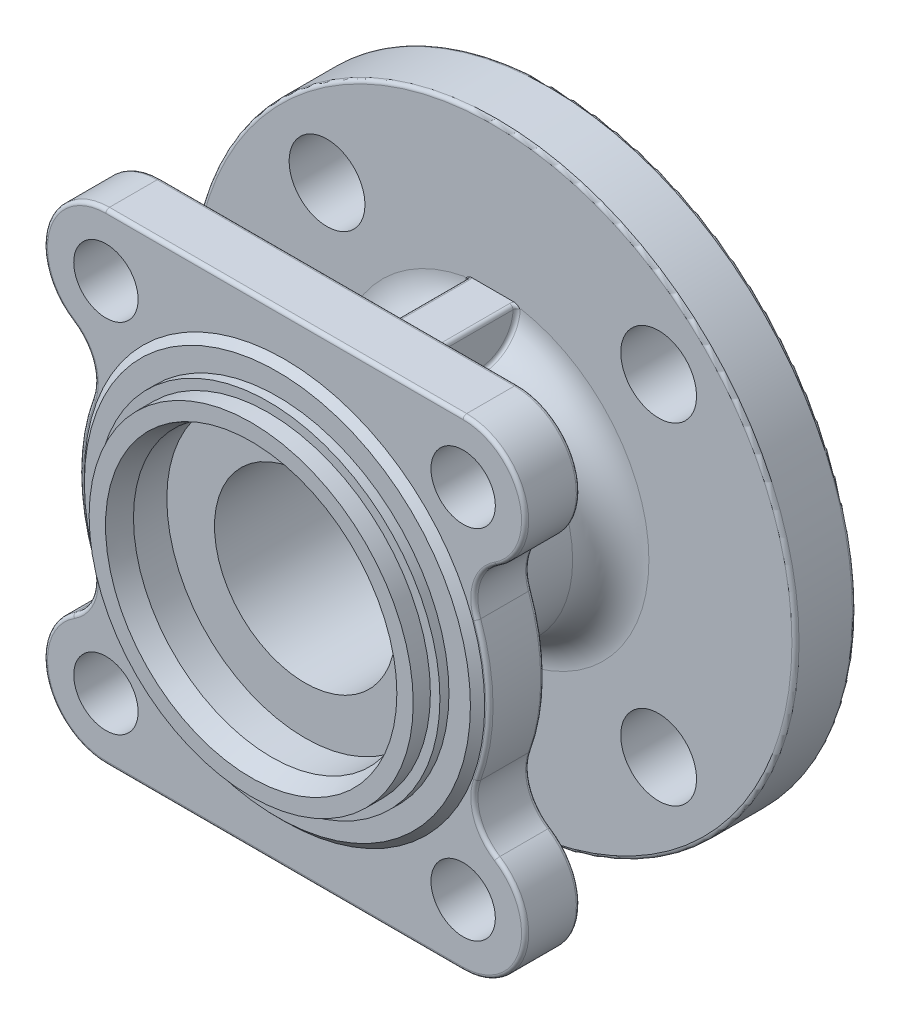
SolidWorks part; units mm, degrees
ref_plane "前基準面" through (0, 0, 0) normal (0, 0, 1) x (1, 0, 0)
ref_plane "上基準面" through (0, 0, 0) normal (0, 1, 0) x (1, 0, 0)
ref_plane "右基準面" through (0, 0, 0) normal (1, 0, 0) x (0, 0, -1)
sketch "草圖2" plane through (0, 0, 0) normal (1, 0, 0) x (0, 0, -1)
  line L0 (-65, 34) -> (-65, 30.5651)
  line L1 (-65, 34) -> (-61.4, 34)
  line L2 (0, 36.5) -> (0, 19)
  line L3 (-41.5814, 0) -> (4.1961, 0) construction
  line L4 (-65, 30.5651) -> (-60.7, 29)
  line L10 (-14.3, 62.75) -> (-14.3, 32.75)
  line L11 (-1.6, 62.75) -> (-1.6, 38.1)
  line L12 (-46.5, 70) -> (-46.5, 32.75)
  line L13 (-61.4, 36) -> (-61.4, 34)
  line L14 (0, 19) -> (-53.7, 19)
  line L15 (-60.7, 29) -> (-53.7, 29)
  line L16 (-53.7, 29) -> (-53.7, 19)
  line L19 (-22.3, 24.75) -> (-38.5, 24.75)
  line L20 (-1.6, 38.1) -> (0, 36.5)
  line L21 (-58, 70) -> (-46.5, 70)
  line L22 (-59.5, 40.5) -> (-58, 42)
  line L23 (-58, 70) -> (-58, 42)
  line L24 (-59.5, 40.5) -> (-59.5, 36)
  line L25 (-61.4, 36) -> (-59.5, 36)
  line L26 (-2.35, 63.5) -> (-13.55, 63.5)
  arc A4 (-46.5, 32.75) -> (-38.5, 24.75) centre (-38.5, 32.75) ccw
  arc A10 (-22.3, 24.75) -> (-14.3, 32.75) centre (-22.3, 32.75) ccw
  arc A16 (-1.6, 62.75) -> (-2.35, 63.5) centre (-2.35, 62.75) ccw
  arc A17 (-13.55, 63.5) -> (-14.3, 62.75) centre (-13.55, 62.75) ccw
  dimension "D9" = 8
  dimension "D5" = 0.75
  dimension "D11" = 13
  dimension "D21" = 140
  dimension "D1" = 38
  dimension "D2" = 65
  dimension "D3" = 1.6
  dimension "D4" = 73
  dimension "D6" = 45
  dimension "D7" = 127
  dimension "D8" = 14.3
  dimension "D10" = 49.5
  dimension "D12" = 3.6
  dimension "D13" = 5.5
  dimension "D14" = 11.3
  dimension "D15" = 58
  dimension "D16" = 68
  dimension "D17" = 72
  dimension "D18" = 45
  dimension "D19" = 84
  dimension "D20" = 7
  dimension "D22" = 7
  dimension "D23" = 20
revolve "旋轉1" add sketch "草圖2" angle 360 about L3
sketch "草圖3" plane through (0, 0, 58) normal (0, 0, 1) x (1, 0, 0)
  line L0 (-37.0478, 0) -> (38.3702, 0) construction
  line L1 (0, 36.3054) -> (0, -39.1126) construction
  line L2 (0, 0) -> (27.2166, 27.2166) construction
  line L3 (-37.4767, 50.4767) -> (37.4767, 50.4767)
  line L4 (-37.4767, -50.4767) -> (37.4767, -50.4767)
  circle A0 centre (0, 0) radius 53 construction
  arc A1 (44.4555, 26.5087) -> (37.4767, 50.4767) centre (37.4767, 37.4767) ccw
  arc A2 (37.4767, -50.4767) -> (44.4555, -26.5087) centre (37.4767, -37.4767) ccw
  arc A3 (-44.4555, -26.5087) -> (-37.4767, -50.4767) centre (-37.4767, -37.4767) ccw
  arc A4 (-37.4767, 50.4767) -> (-44.4555, 26.5087) centre (-37.4767, 37.4767) ccw
  circle A5 centre (0, 0) radius 70 construction
  circle A6 centre (0, 0) radius 70
  arc A9 (-40.4231, 14.662) -> (-40.4231, -14.662) centre (0, 0) ccw
  arc A10 (40.4231, -14.662) -> (40.4231, 14.662) centre (0, 0) ccw
  arc A11 (-40.4231, 14.662) -> (-44.4555, 26.5087) centre (-49.8238, 18.0718) ccw
  arc A12 (-44.4555, -26.5087) -> (-40.4231, -14.662) centre (-49.8238, -18.0718) ccw
  arc A13 (40.4231, -14.662) -> (44.4555, -26.5087) centre (49.8238, -18.0718) ccw
  arc A14 (44.4555, 26.5087) -> (40.4231, 14.662) centre (49.8238, 18.0718) ccw
  circle A15 centre (0, 0) radius 43
  circle A16 centre (0, 0) radius 43 construction
  dimension "D1" = 106
  dimension "D3" = 1
  dimension "D6" = 10
  dimension "D2" = 13
extrude "除料-伸長2" cut sketch "草圖3" against normal up to surface (11.5 mm away)
sketch "草圖6" plane through (0, 0, 0) normal (0, 0, -1) x (-1, 0, 0)
  line L0 (-23.7091, 0) -> (23.7091, 0) construction
  line L1 (0, 22.9364) -> (0, -22.9364) construction
  line L2 (0, 0) -> (24.178, 24.178) construction
  circle A0 centre (0, 0) radius 49.2 construction
  circle A1 centre (34.7897, 34.7897) radius 7.95
  circle A2 centre (34.7897, -34.7897) radius 7.95
  circle A3 centre (-34.7897, -34.7897) radius 7.95
  circle A4 centre (-34.7897, 34.7897) radius 7.95
  dimension "D3" = 15.9
  dimension "D1" = 98.4
extrude "除料-伸長1" cut sketch "草圖6" against normal up to surface (14.3 mm away)
sketch "草圖7" plane through (0, 0, 59.5) normal (0, 0, 1) x (1, 0, 0)
  line L0 (0, 0) -> (38.6097, 0) construction
  line L1 (0, 0) -> (29.9708, 29.9708) construction
  circle A0 centre (0, 0) radius 53 construction
  circle A1 centre (37.4767, 37.4767) radius 6.75
  circle A2 centre (37.4767, -37.4767) radius 6.75
  circle A3 centre (-37.4767, -37.4767) radius 6.75
  circle A4 centre (-37.4767, 37.4767) radius 6.75
  dimension "D1" = 13.5
  dimension "D2" = 106
extrude "除料-伸長3" cut sketch "草圖7" against normal up to surface (13 mm away)
sketch "草圖8" plane through (0, 0, 0) normal (1, 0, 0) x (0, 0, -1)
  line L0 (-46.5, 32.75) -> (-14.3, 32.75)
  line L1 (-46.5, 26.5087) -> (-46.5, 50.4767) construction
  line L2 (-14.3, 62.75) -> (-14.3, -62.75) construction
  line L3 (-14.3, 32.75) -> (-14.3, 19)
  line L4 (-14.3, 19) -> (-46.5, 19)
  line L5 (-46.5, -14.662) -> (-46.5, 14.662) construction
  line L7 (-46.5, 19) -> (-46.5, 32.75)
  line L8 (-58.6465, 0) -> (1.413, 0) construction
  line L10 (-46.5, -19) -> (-14.3, -19)
  line L11 (-46.5, -19) -> (-46.5, -32.75)
  line L12 (-46.5, -32.75) -> (-14.3, -32.75)
  line L13 (-14.3, -19) -> (-14.3, -32.75)
  line L14 (0, 19) -> (-53.7, 19) construction
  line L15 (-53.7, -19) -> (0, -19) construction
extrude "伸長1" add sketch "草圖8" along normal mid plane 10
fillet "圓角2" radius 0.75 44 edges at (-40.3572, 21.2941, 46.5) (-43, 0, 46.5) (-40.3572, -21.2941, 46.5) (-49.9583, -41.111, 46.5) (0, -50.4767, 46.5) (49.9583, -41.111, 46.5) (40.3572, -21.2941, 46.5) (43, 0, 46.5) (40.3572, 21.2941, 46.5) (49.9583, 41.111, 46.5) (0, 50.4767, 46.5) (0, 50.4767, 58) (49.9583, 41.111, 58) (40.3572, 21.2941, 58) (43, 0, 58) (40.3572, -21.2941, 58) (49.9583, -41.111, 58) (0, -50.4767, 58) (-49.9583, -41.111, 58) (-40.3572, -21.2941, 58) (-43, 0, 58) (-40.3572, 21.2941, 58) (-5, -32.558, 46.5) (-5, -38.1121, 32.8752) (-5, -32.558, 14.3) (-5, -37.2755, 28.6551) (5, -32.558, 46.5) (5, -38.1121, 32.8752) (5, -32.558, 14.3) (5, -37.2755, 28.6551) (5, 32.558, 46.5) (5, 38.5786, 33.3852) (5, 32.558, 14.3) (5, 37.5358, 28.4492) (-5, 32.558, 46.5) (-5, 38.5786, 33.3852) (-5, 32.558, 14.3) (-5, 37.5358, 28.4492) (-49.9583, 41.111, 46.5) (-49.9583, 41.111, 58) (-5, -24.2397, 30.4) (5, -24.2397, 30.4) (5, 24.2397, 30.4) (-5, 24.2397, 30.4)
fillet "圓角3" radius 0.75 12 edges at (-5.2197, -32.75, 46.2803) (-5.2197, -32.75, 14.5197) (5.2197, -32.75, 46.2803) (5.2197, -32.75, 14.5197) (-5.2197, 32.75, 14.5197) (-5.2197, 32.75, 46.2803) (5.2197, 32.75, 14.5197) (5.2197, 32.75, 46.2803) (-5, -32.75, 30.4) (5, -32.75, 30.4) (-5, 32.75, 30.4) (5, 32.75, 30.4)
